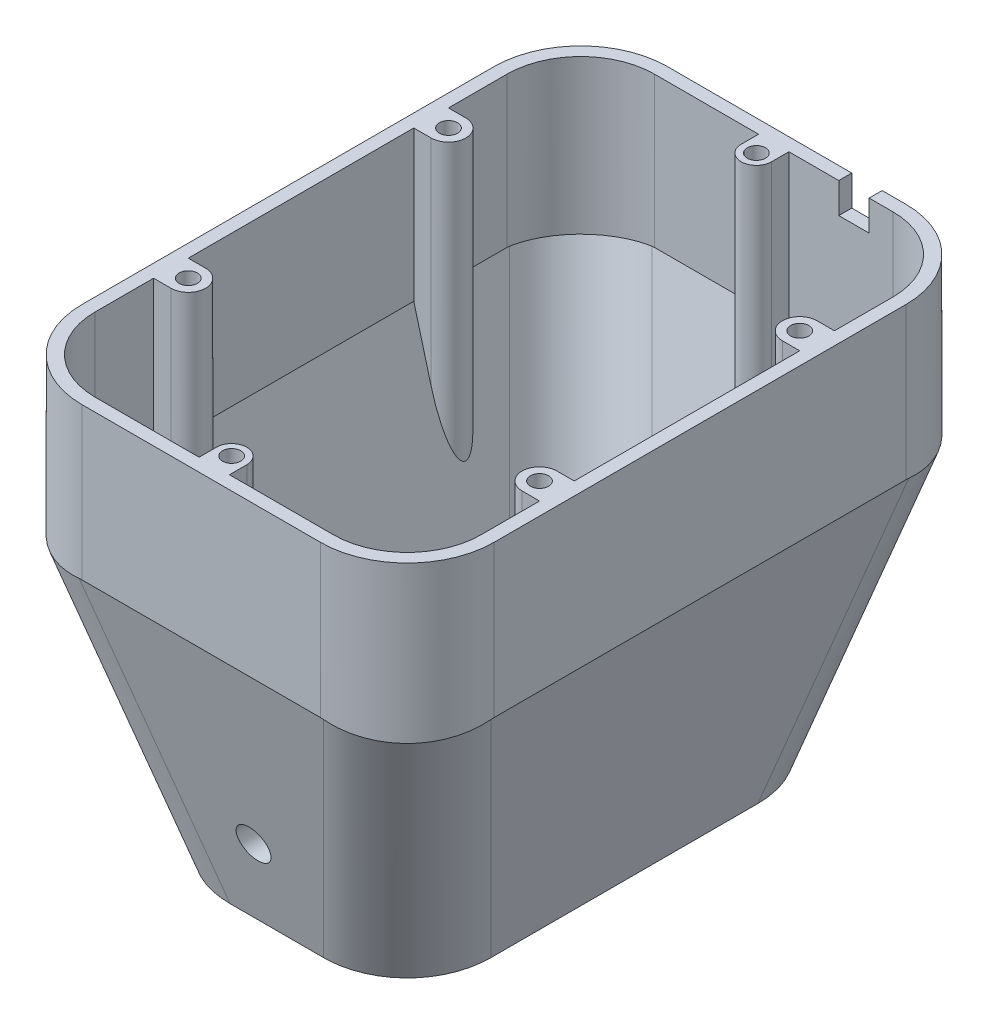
SolidWorks part; units mm, degrees
ref_plane "Front Plane" through (0, 0, 0) normal (0, 0, 1) x (1, 0, 0)
ref_plane "Top Plane" through (0, 0, 0) normal (0, 1, 0) x (1, 0, 0)
ref_plane "Right Plane" through (0, 0, 0) normal (1, 0, 0) x (0, 0, -1)
sketch "Sketch1" plane through (0, 0, 0) normal (0, 1, 0) x (1, 0, 0)
  line L1 (-47.5, -67.5) -> (47.5, -67.5)
  line L2 (-47.5, -67.5) -> (-47.5, 67.5)
  line L3 (-47.5, 67.5) -> (47.5, 67.5)
  line L4 (47.5, -67.5) -> (47.5, 67.5)
  line L5 (-47.5, -67.5) -> (47.5, 67.5) construction
  line L6 (-47.5, 67.5) -> (47.5, -67.5) construction
  point P0 (0, 0)
extrude "Boss-Extrude1" add sketch "Sketch1" against normal blind 65
sketch "Sketch3" plane through (0, -65, 0) normal (0, -1, 0) x (1, 0, 0)
  line L4 (47.5, -67.5) -> (47.5, 67.5)
  line L5 (47.5, 67.5) -> (-47.5, 67.5)
  line L6 (-47.5, 67.5) -> (-47.5, -67.5)
  line L7 (-47.5, -67.5) -> (47.5, -67.5)
  line L8 (47.5, -67.5) -> (47.5, 67.5)
  line L9 (47.5, 67.5) -> (-47.5, 67.5)
  line L10 (-47.5, 67.5) -> (-47.5, -67.5)
  line L11 (-47.5, -67.5) -> (47.5, -67.5)
  dimension "D1" = 0
draft "Draft1" type of draft neutral plane draft angle 15 faces to draft 4 parameters "D1"=15
sketch "Sketch4" plane through (0, 0, 0) normal (0, 1, 0) x (1, 0, 0)
  line L4 (47.5, -67.5) -> (47.5, 67.5)
  line L5 (47.5, 67.5) -> (-47.5, 67.5)
  line L6 (-47.5, 67.5) -> (-47.5, -67.5)
  line L7 (-47.5, -67.5) -> (47.5, -67.5)
  line L8 (47.5, -67.5) -> (47.5, 67.5)
  line L9 (47.5, 67.5) -> (-47.5, 67.5)
  line L10 (-47.5, 67.5) -> (-47.5, -67.5)
  line L11 (-47.5, -67.5) -> (47.5, -67.5)
  dimension "D1" = 0
extrude "Boss-Extrude3" add sketch "Sketch4" along normal blind 35
fillet "Fillet5" radius 20 8 edges at (-47.5, 17.5, 67.5) (-38.7917, -32.5, 58.7917) (38.7917, -32.5, 58.7917) (47.5, 17.5, 67.5) (38.7917, -32.5, -58.7917) (47.5, 17.5, -67.5) (-47.5, 17.5, -67.5) (-38.7917, -32.5, -58.7917)
shell "Shell1" thickness 3
sketch "Sketch5" plane through (0, 35, 0) normal (0, 1, 0) x (1, 0, 0)
  line L1 (-52.25, 0) -> (52.25, 0) construction
  line L2 (-47.5, 47.5) -> (-47.5, -47.5) construction
  line L3 (-40.5, 26) -> (-44.5, 26)
  line L4 (-44.5, 47.5) -> (-44.5, -47.5) construction
  line L5 (-44.5, 26) -> (-44.5, 34)
  line L6 (-44.5, 34) -> (-40.5, 34)
  arc A0 (-40.5, 26) -> (-40.5, 34) centre (-40.5, 30) ccw
  circle A1 centre (-40.5, 30) radius 2.1
  dimension "D1" = 7
  dimension "D2" = 30
extrude "Boss-Extrude4" add sketch "Sketch5" against normal up to body
mirror "Mirror1" about plane through (0, 0, 0) normal (1, 0, 0) of "Boss-Extrude4"
mirror "Mirror2" about plane through (0, 0, 0) normal (0, 0, 1) of "Boss-Extrude4", "Mirror1"
sketch "Sketch6" plane through (0, 35, 0) normal (0, 1, 0) x (1, 0, 0)
  line L0 (0, -55) -> (0, 55) construction
  line L3 (-47.5, 67.5) -> (47.5, 67.5) construction
  line L4 (-3.5, 60.5) -> (-3.5, 64.5)
  line L5 (27.5, 64.5) -> (-27.5, 64.5) construction
  line L6 (-3.5, 64.5) -> (3.5, 64.5)
  line L7 (3.5, 64.5) -> (3.5, 60.5)
  circle A0 centre (0, 60.5) radius 2.1
  arc A1 (-3.5, 60.5) -> (3.5, 60.5) centre (0, 60.5) ccw
  dimension "D1" = 7
extrude "Boss-Extrude5" add sketch "Sketch6" against normal up to body
mirror "Mirror3" about plane through (0, 0, 0) normal (0, 0, 1) of "Boss-Extrude5"
ref_plane "Plane1" through (0, 0, 40.5) normal (0, 0, 1) x (1, 0, 0)
sketch "Sketch7" plane through (0, 0, 40.5) normal (0, 0, 1) x (1, 0, 0)
  line L0 (0, -55) -> (0, 55) construction
  line L1 (6, -45) -> (6, -65)
  line L2 (47.5, -65) -> (-47.5, -65) construction
  line L3 (6, -65) -> (-6, -65)
  line L4 (-6, -65) -> (-6, -45)
  line L5 (-30.0833, -65) -> (-10.7648, -65) construction
  circle A0 centre (0, -45) radius 3.9
  arc A1 (6, -45) -> (-6, -45) centre (0, -45) ccw
  dimension "D1" = 20
extrude "Boss-Extrude6" add sketch "Sketch7" along normal up to surface (11.8365 mm away)
ref_plane "Plane2" through (0, 0, -15.5) normal (0, 0, -1) x (-1, 0, 0)
sketch "Sketch8" plane through (0, 0, -15.5) normal (0, 0, -1) x (-1, 0, 0)
  line L3 (-6, -45) -> (-6, -62)
  line L4 (-6, -62) -> (6, -62)
  line L5 (6, -62) -> (6, -45)
  line L6 (-6, -45) -> (-6, -62)
  line L7 (-6, -62) -> (6, -62)
  line L8 (6, -62) -> (6, -45)
  arc A1 (6, -45) -> (-6, -45) centre (0, -45) ccw
  arc A2 (6, -45) -> (-6, -45) centre (0, -45) ccw
  circle A3 centre (0, -45) radius 3.9
  circle A4 centre (0, -45) radius 3.9
  dimension "D1" = 0
  dimension "D2" = 0
extrude "Boss-Extrude7" add sketch "Sketch8" along normal up to surface (32.2813 mm away)
sketch "Sketch9" plane through (0, 0, 67.5) normal (0, 0, 1) x (1, 0, 0)
  circle A1 centre (0, -45) radius 3.9
  circle A2 centre (0, -45) radius 3.9
  dimension "D1" = 0
extrude "Cut-Extrude1" cut sketch "Sketch9" against normal up to surface (27 mm away)
sketch "Sketch10" plane through (0, -62, 0) normal (0, 1, 0) x (1, 0, 0)
  line L0 (0, -55) -> (0, 55) construction
  circle A0 centre (0, -26.0995) radius 2.7
  circle A1 centre (0, -11.0995) radius 2.7
  dimension "D1" = 15
extrude "Cut-Extrude2" cut sketch "Sketch10" against normal through all
sketch "Sketch11" plane through (0, 0, -64.5) normal (0, 0, 1) x (1, 0, 0)
  line L0 (-27.5, 35) -> (27.5, 35) construction
  line L1 (15, 35) -> (22, 35)
  line L2 (15, 35) -> (15, 28)
  line L3 (15, 28) -> (22, 28)
  line L4 (22, 35) -> (22, 28)
  line L5 (0, -55) -> (0, 55) construction
  dimension "D1" = 7
  dimension "D2" = 7
  dimension "D3" = 15
extrude "Cut-Extrude3" cut sketch "Sketch11" against normal through all
